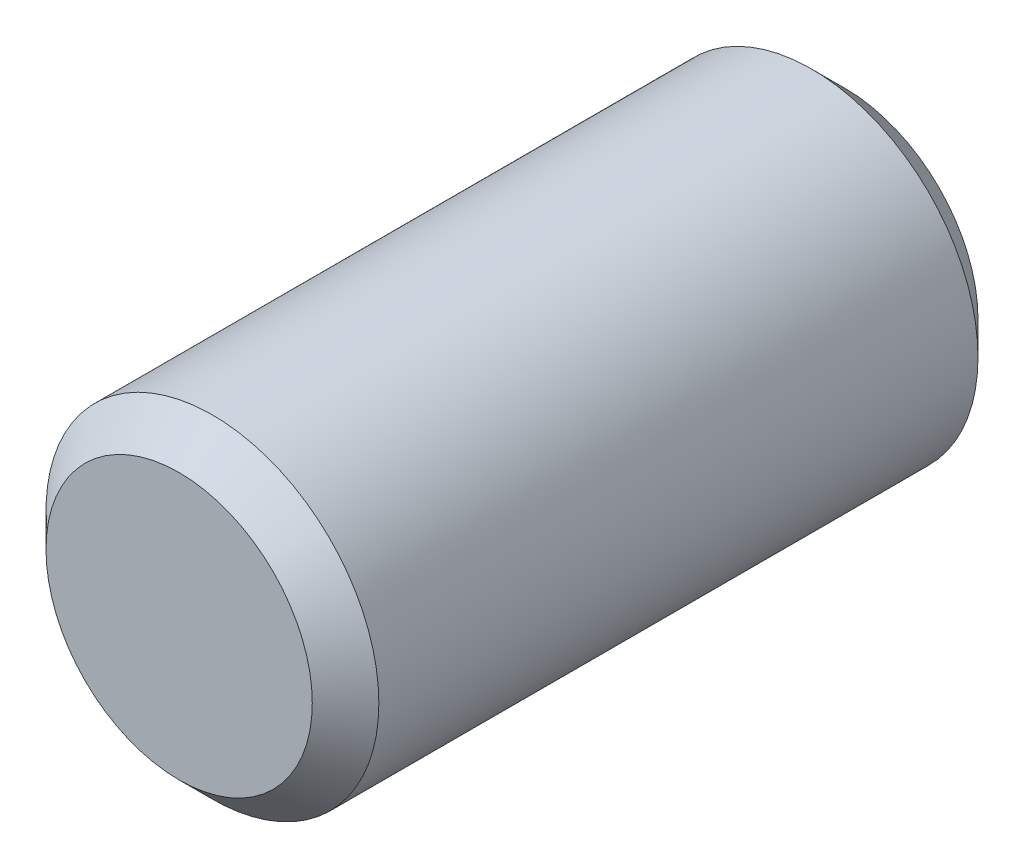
SolidWorks part; units mm, degrees
ref_plane "FACE" through (0, 0, 0) normal (0, 0, 1) x (1, 0, 0)
ref_plane "DESSUS" through (0, 0, 0) normal (0, 1, 0) x (1, 0, 0)
ref_plane "GAUCHE" through (0, 0, 0) normal (1, 0, 0) x (0, 0, -1)
sketch "Esquisse1" plane through (0, 0, 0) normal (0, 0, 1) x (1, 0, 0)
  circle A0 centre (0, 0) radius 1
  dimension "D1" = 2
extrude "Base-Extrusion" add sketch "Esquisse1" along normal blind 4
chamfer "Chanfrein1" distance 0.2 angle 45
